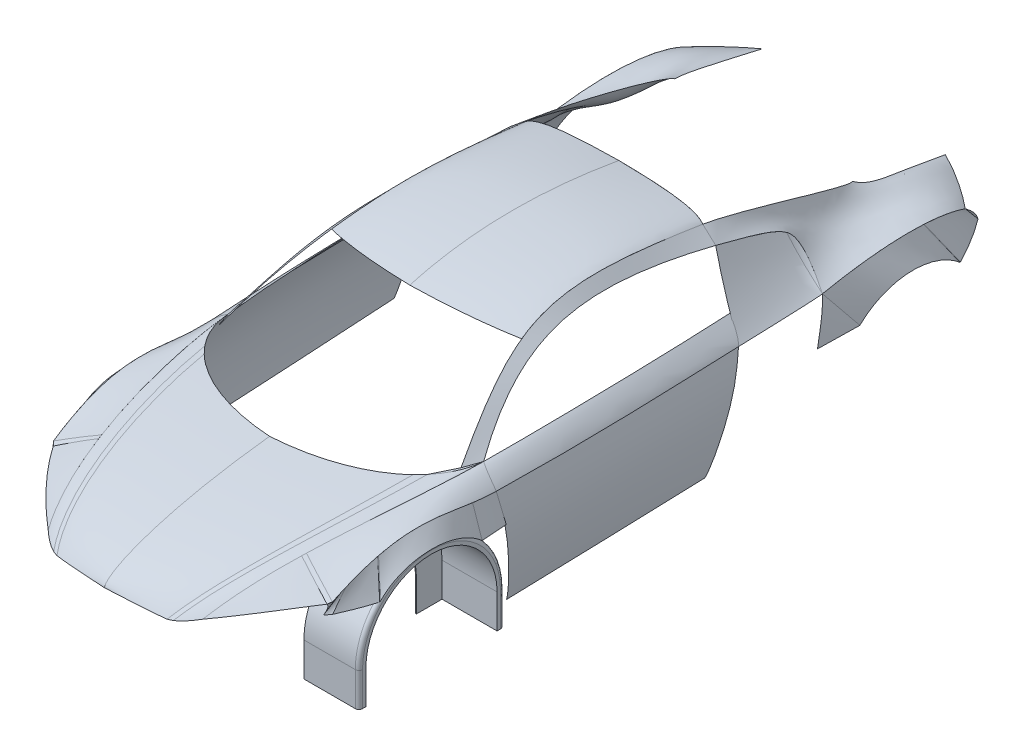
SolidWorks part; units mm, degrees
ref_plane "Front Plane" through (0, 0, 0) normal (0, 0, 1) x (1, 0, 0)
ref_plane "Top Plane" through (0, 0, 0) normal (0, 1, 0) x (1, 0, 0)
ref_plane "Right Plane" through (0, 0, 0) normal (1, 0, 0) x (0, 0, -1)
sketch "Front View Audi R8"
sketch "Side View Audi R8"
sketch "Top View Audi R8"
ref_plane "Rear Plane" through (0, 0, -4431) normal (0, 0, 1) x (1, 0, 0)
sketch "Rear View Audi R8"
sketch "Sketch1" plane through (0, 0, 0) normal (1, 0, 0) x (0, 0, -1)
  spline S0 degree 2 poles (1428.6782, 826.8415) (1886.7808, 852.6113) (2789.3564, 869.7489) knots 0 0 0 1 1 1
sketch "Sketch2" plane through (0, 0, 0) normal (0, 1, 0) x (1, 0, 0)
  spline S0 degree 3 poles (705.164, 1440.3029) (730.5597, 1835.8101) (729.8295, 2428.7311) (718.3423, 2787.8085) knots 0 0 0 0 1 1 1 1
curve "Curve1"
sketch "Sketch3" plane through (0, 0, 0) normal (1, 0, 0) x (0, 0, -1)
  spline S0 degree 2 poles (1408.5355, 746.0644) (1922.2158, 750.257) (2751.8469, 774.6725) knots 0 0 0 1 1 1
sketch "Sketch4" plane through (0, 0, 0) normal (0, 1, 0) x (1, 0, 0)
  spline S0 degree 3 poles (806.5504, 2746.6217) (807.7331, 2449.6597) (820.0794, 2025.1062) (801.0457, 1414.1873) knots 0 0 0 0 1 1 1 1
curve "Curve2"
sketch "Sketch5" plane through (0, 0, 0) normal (1, 0, 0) x (0, 0, -1)
  spline S0 degree 2 poles (1440.3029, 827.4901) (1417.7829, 811.024) (1414.661, 746.115) knots 0 0 0 1 1 1
  spline S1 degree 3 poles (2787.8085, 869.7195) (2731.6457, 868.6522) (2675.4768, 867.5353) (2563.1321, 865.1869) (2506.9561, 863.9554) (2338.4203, 860.0594) (2226.0532, 857.1983) (2001.3722, 850.7012) (1889.0328, 847.0738) (1720.6415, 840.6761) (1664.5313, 838.3819) (1552.3674, 833.3368) (1496.3131, 830.5896) (1440.3029, 827.4901) knots 0 0 0 0 0.125 0.125 0.25 0.25 0.5 0.5 0.75 0.75 0.875 0.875 1 1 1 1 construction
  spline S2 degree 3 poles (1414.1873, 746.1111) (1525.2078, 747.0381) (1636.2383, 748.5585) (1858.3266, 752.3126) (1969.3802, 754.5543) (2191.4673, 759.5367) (2302.5088, 762.2801) (2469.056, 766.6744) (2524.5695, 768.1863) (2635.5952, 771.2928) (2691.1073, 772.8874) (2746.6217, 774.5189) knots 0 0 0 0 0.25 0.25 0.5 0.5 0.75 0.75 0.875 0.875 1 1 1 1 construction
sketch "Sketch6" plane through (0, 0, 0) normal (0, 1, 0) x (1, 0, 0)
  spline S0 degree 2 poles (705.2031, 1440.9116) (743.5412, 1417.487) (801.0508, 1414.3495) knots 0 0 0 1 1 1
  spline S1 degree 3 poles (718.3423, 2787.8085) (720.139, 2731.6457) (721.5067, 2675.4768) (723.6776, 2563.1321) (724.4731, 2506.9561) (726.1346, 2338.4203) (726.292, 2226.0532) (724.6866, 2001.3722) (722.9339, 1889.0328) (718.2644, 1720.6415) (716.3625, 1664.5313) (711.6053, 1552.3674) (708.7605, 1496.3131) (705.164, 1440.3029) knots 0 0 0 0 0.125 0.125 0.25 0.25 0.5 0.5 0.75 0.75 0.875 0.875 1 1 1 1 construction
  spline S2 degree 3 poles (801.0457, 1414.1873) (804.5047, 1525.2078) (807.1155, 1636.2383) (810.6084, 1858.3266) (811.4829, 1969.3802) (811.6541, 2191.4673) (810.924, 2302.5088) (809.2256, 2469.056) (808.5647, 2524.5695) (807.3423, 2635.5952) (806.7715, 2691.1073) (806.5504, 2746.6217) knots 0 0 0 0 0.25 0.25 0.5 0.5 0.75 0.75 0.875 0.875 1 1 1 1 construction
curve "Curve3"
sketch "Sketch7" plane through (0, 0, 0) normal (1, 0, 0) x (0, 0, -1)
  spline S0 degree 2 poles (2787.8085, 869.7195) (2763.5948, 797.8808) (2743.2754, 774.4206) knots 0 0 0 1 1 1
  spline S1 degree 3 poles (2787.8085, 869.7195) (2731.6457, 868.6522) (2675.4768, 867.5353) (2563.1321, 865.1869) (2506.9561, 863.9554) (2338.4203, 860.0594) (2226.0532, 857.1983) (2001.3722, 850.7012) (1889.0328, 847.0738) (1720.6415, 840.6761) (1664.5313, 838.3819) (1552.3674, 833.3368) (1496.3131, 830.5896) (1440.3029, 827.4901) knots 0 0 0 0 0.125 0.125 0.25 0.25 0.5 0.5 0.75 0.75 0.875 0.875 1 1 1 1 construction
  spline S2 degree 3 poles (1414.1873, 746.1111) (1525.2078, 747.0381) (1636.2383, 748.5585) (1858.3266, 752.3126) (1969.3802, 754.5543) (2191.4673, 759.5367) (2302.5088, 762.2801) (2469.056, 766.6744) (2524.5695, 768.1863) (2635.5952, 771.2928) (2691.1073, 772.8874) (2746.6217, 774.5189) knots 0 0 0 0 0.25 0.25 0.5 0.5 0.75 0.75 0.875 0.875 1 1 1 1 construction
sketch "Sketch8" plane through (0, 0, 0) normal (0, 1, 0) x (1, 0, 0)
  spline S0 degree 2 poles (718.3423, 2787.8085) (790.5151, 2766.1674) (806.5519, 2746.2486) knots 0 0 0 1 1 1
  spline S1 degree 3 poles (718.3423, 2787.8085) (720.139, 2731.6457) (721.5067, 2675.4768) (723.6776, 2563.1321) (724.4731, 2506.9561) (726.1346, 2338.4203) (726.292, 2226.0532) (724.6866, 2001.3722) (722.9339, 1889.0328) (718.2644, 1720.6415) (716.3625, 1664.5313) (711.6053, 1552.3674) (708.7605, 1496.3131) (705.164, 1440.3029) knots 0 0 0 0 0.125 0.125 0.25 0.25 0.5 0.5 0.75 0.75 0.875 0.875 1 1 1 1 construction
  spline S2 degree 3 poles (801.0457, 1414.1873) (804.5047, 1525.2078) (807.1155, 1636.2383) (810.6084, 1858.3266) (811.4829, 1969.3802) (811.6541, 2191.4673) (810.924, 2302.5088) (809.2256, 2469.056) (808.5647, 2524.5695) (807.3423, 2635.5952) (806.7715, 2691.1073) (806.5504, 2746.6217) knots 0 0 0 0 0.25 0.25 0.5 0.5 0.75 0.75 0.875 0.875 1 1 1 1 construction
curve "Curve4"
surface "Surface-Loft1"
sketch "Sketch11" plane through (0, 0, 0) normal (1, 0, 0) x (0, 0, -1)
  spline S0 degree 3 poles (2513.9659, 291.6627) (2260.0908, 279.3432) (1897.9939, 262.4992) (1427.5698, 243.2458) knots 0 0 0 0 1 1 1 1
sketch "Sketch12" plane through (0, 0, 0) normal (0, 1, 0) x (1, 0, 0)
  spline S0 degree 1 poles (844.1348, 1416.9072) (858.5007, 2509.2941) knots 0 0 1 1
curve "Curve6"
sketch "Sketch16" plane through (0, 0, 0) normal (1, 0, 0) x (0, 0, -1)
  spline S0 degree 2 poles (2746.6217, 774.5189) (2567.4192, 353.4796) (2508.6204, 291.4034) knots 0 0 0 1 1 1
  spline S1 degree 3 poles (2509.2941, 291.4361) (2148.7842, 273.9547) (1788.2013, 258.0056) (1427.5698, 243.2458) knots 0 0 0 0 1 1 1 1 construction
sketch "Sketch17" plane through (0, 0, 0) normal (0, 1, 0) x (1, 0, 0)
  line L0 (858.5007, 2509.2941) -> (844.275, 1427.5698) construction
  spline S0 degree 3 poles (806.5504, 2746.6217) (855.5306, 2685.6074) (867.8574, 2640.3171) (858.4798, 2507.7028) knots 0 0 0 0 1 1 1 1
curve "Curve8"
surface "Surface-Loft2"
sketch "Sketch18" plane through (0, 0, 0) normal (1, 0, 0) x (0, 0, -1)
  spline S0 degree 2 poles (2746.6217, 774.5189) (3168.0734, 779.6193) (3218.7511, 787.241) knots 0 0 0 1 1 1
sketch "Sketch19" plane through (0, 0, 0) normal (0, 1, 0) x (1, 0, 0)
  spline S0 degree 2 poles (806.5504, 2746.6217) (805.4175, 3038.5008) (798.3297, 3216.7936) knots 0 0 0 1 1 1
curve "Curve10"
sketch "Sketch20" plane through (0, 0, 0) normal (1, 0, 0) x (0, 0, -1)
  spline S0 degree 2 poles (2853.7058, 1076.1229) (3132.7599, 1018.7829) (3211.4713, 983.5418) knots 0 0 0 1 1 1
sketch "Sketch21" plane through (0, 0, 0) normal (0, 1, 0) x (1, 0, 0)
  spline S0 degree 1 poles (566.9061, 2852.3388) (601.1217, 3222.6865) knots 0 0 1 1
curve "Curve11"
surface "Surface-Knit1"
sketch "Sketch22" plane through (0, 0, 0) normal (1, 0, 0) x (0, 0, -1)
  spline S1 degree 3 poles (166.7135, 570.3457) (356.5419, 711.1668) (713.8164, 794.4388) (1440.3029, 827.4901) knots 0 0 0 0 1 1 1 1
sketch "Sketch24" plane through (0, 0, 0) normal (0, 1, 0) x (1, 0, 0)
  spline S0 degree 3 poles (423.2978, 160.7351) (521.9825, 342.807) (681.5816, 1027.9178) (705.164, 1440.3029) knots 0 0 0 0 1 1 1 1
curve "Curve12"
sketch "Sketch25" plane through (0, 0, 0) normal (0, 1, 0) x (1, 0, 0)
  line L0 (0, -725.1255) -> (0, 725.1255) construction
  line L1 (0, 166.7135) -> (0, 1440.3029) construction
  spline S0 degree 3 poles (705.164, 1440.3029) (686.7542, 1177.0729) (396.9525, 988.6463) (0, 962.8897) knots 0 0 0 0 1 1 1 1
sketch "Sketch27" plane through (0, 0, 0) normal (1, 0, 0) x (0, 0, -1)
  line L3 (962.8897, 0) -> (962.8897, 2273.9137) construction
  spline S0 degree 1 poles (1440.3029, 827.4901) (962.8897, 833.9857) knots 0 0 1 1
curve "Curve13"
sketch "Sketch28" plane through (0, 0, 0) normal (1, 0, 0) x (0, 0, -1)
  spline S2 degree 3 poles (962.8809, 833.987) (354.1408, 764.7137) (56.7003, 627.7857) (51.3469, 565.1912) knots 0 0 0 0 1 1 1 1
sketch "Sketch30" plane through (0, 0, 0) normal (0, 1, 0) x (1, 0, 0)
  line L1 (0, -725.1255) -> (0, 725.1255) construction
  spline S0 degree 2 poles (423.2978, 160.7351) (370.639, 114.4835) (328.0977, 97.3733) knots 0 0 0 1 1 1
  spline S1 degree 2 poles (0, 56.6169) (258.3276, 73.121) (328.0977, 97.3733) knots 0 0 0 1 1 1
sketch "Sketch31" plane through (0, 0, 0) normal (1, 0, 0) x (0, 0, -1)
  spline S0 degree 1 poles (51.3469, 565.1912) (90.059, 544.3675) knots 0 0 1 1
  spline S1 degree 1 poles (90.059, 544.3675) (166.7135, 570.3457) knots 0 0 1 1
curve "Curve14"
surface "Surface-Loft4"
sketch "Sketch32" plane through (0, 0, 0) normal (1, 0, 0) x (0, 0, -1)
  spline S0 degree 3 poles (1414.1873, 746.1111) (1230.5727, 749.0045) (1160.5603, 784.7669) (990.9877, 780.0125) knots 0 0 0 0 1 1 1 1
  spline S1 degree 2 poles (990.9877, 780.0125) (769.8549, 775.0439) (523.9418, 628.716) knots 0 0 0 1 1 1
  spline S2 degree 3 poles (166.7135, 570.3457) (308.5429, 610.4682) (405.1047, 624.322) (523.9418, 628.716) knots 0 0 0 0 1 1 1 1
  spline S3 degree 1 poles (92.4284, 546.6531) (166.7135, 570.3457) knots 0 0 1 1
sketch "Sketch33" plane through (0, 0, 0) normal (0, 1, 0) x (1, 0, 0)
  spline S1 degree 3 poles (801.0457, 1414.1873) (795.7108, 1043.2584) (782.7383, 743.1049) (770.4202, 539.8306) knots 0 0 0 0 0.995264 0.995264 0.995264 0.995264
  spline S2 degree 3 poles (426.4666, 166.7135) (666.9588, 364.1571) (745.8449, 521.9796) (770.4202, 539.8306) knots 0 0 0 0 1 1 1 1
curve "Curve15"
surface "Surface-Loft6"
sketch "Sketch34" plane through (0, 0, 0) normal (1, 0, 0) x (0, 0, -1)
  spline S0 degree 1 poles (1425.7898, 602.8072) (1283.8785, 601.7667) knots 0 0 1 1
  spline S1 degree 3 poles (1426.8962, 243.2131) (1428.2442, 247.5995) (1430.1162, 256.9134) (1432.5664, 276.3921) (1434.1988, 301.6806) (1435.0914, 332.7528) (1435.3041, 374.6862) (1434.3432, 427.7651) (1431.9716, 491.8634) (1429.263, 545.4122) (1426.7604, 588.2728) (1423.9454, 630.8821) (1419.874, 683.6228) (1416.1377, 725.3255) (1414.1873, 746.1111) knots 0 0 0 0 0.03125 0.0625 0.125 0.1875 0.25 0.375 0.5 0.625 0.6875 0.75 0.875 1 1 1 1 construction
  spline S2 degree 1 poles (513.1356, 577.4986) (720.8256, 587.0843) knots 0 0 1 1
  spline S3 degree 3 poles (720.8256, 587.0843) (837.9393, 726.6038) (1108.5769, 755.6842) (1283.8785, 601.7667) knots 0 0 0 0 1 1 1 1
  spline S4 degree 2 poles (523.9418, 628.716) (532.423, 614.2875) (513.1356, 577.4986) knots 0 0 0 1 1 1
sketch "Sketch35" plane through (0, 0, 0) normal (0, 1, 0) x (1, 0, 0)
  spline S0 degree 2 poles (770.4202, 539.8306) (823.0419, 642.18) (851.5058, 724.2331) knots 0 0 0 1 1 1
  spline S1 degree 3 poles (851.5058, 724.2331) (860.8621, 946.7661) (864.4796, 1181.5274) (844.3187, 1426.8962) knots 0 0 0 0 1 1 1 1
  spline S2 degree 3 poles (426.4666, 166.7135) (571.8997, 274.5997) (760.141, 534.0673) (770.4202, 539.8306) knots 0 0 0 0 1 1 1 1
curve "Curve16"
surface "Surface-Loft7"
sketch "Sketch39" plane through (0, 0, 0) normal (1, 0, 0) x (0, 0, -1)
  line L0 (1493.001, 314.9487) -> (584.0039, 314.9487) construction
  line L1 (1003.7078, 732.7326) -> (1003.7078, -54.9122) construction
  line L2 (641.5034, 314.9487) -> (641.5034, 128.0571)
  line L3 (641.5034, 128.0571) -> (602.7587, 128.0571)
  line L4 (602.7587, 128.0571) -> (602.7587, 314.9487)
  line L5 (1365.9122, 314.9487) -> (1365.9122, 128.0571)
  line L6 (1365.9122, 128.0571) -> (1404.6569, 128.0571)
  line L7 (1404.6569, 128.0571) -> (1404.6569, 314.9487)
  line L8 (1404.6569, 314.9487) -> (1407.1755, 316.3853)
  arc A2 (1365.9122, 314.9487) -> (641.5034, 314.9487) centre (1003.7078, 314.9487) ccw
  arc A3 (1404.6569, 314.9487) -> (602.7587, 314.9487) centre (1003.7078, 314.9487) ccw
extrude "Boss-Extrude3" add sketch "Sketch39" along normal up to vertex contours A3 L4 L3 L2 A2 L5 L6 L7
sketch "Sketch40" plane through (0, 0, -4431) normal (0, 0, 1) x (1, 0, 0)
  line L1 (549.6351, 101.7431) -> (-37.9847, 101.7431)
  line L2 (549.6351, 101.7431) -> (549.6351, 756.3824)
  line L3 (549.6351, 756.3824) -> (-37.9847, 756.3824)
  line L4 (-37.9847, 101.7431) -> (-37.9847, 756.3824)
extrude "Cut-Extrude2" cut sketch "Sketch40" along normal up to vertex
fillet "Fillet1" radius 20 3 edges at (853.5675, 221.5029, -1404.6569) (853.5675, 221.5029, -602.7587) (853.5675, 715.8979, -1003.7078)
sketch "Sketch42" plane through (0, 0, 0) normal (0, 1, 0) x (1, 0, 0)
  line L1 (546.0539, 1410.5372) -> (490.4985, 1410.5372)
  line L2 (546.0539, 1410.5372) -> (546.0539, 641.5034)
  line L3 (546.0539, 641.5034) -> (490.4985, 641.5034)
  line L4 (490.4985, 1410.5372) -> (490.4985, 641.5034)
  spline S0 degree 3 poles (576.8385, 1178.623) (574.0102, 1148.8218) (567.6143, 1090.1219) (560.1474, 1033.1626) (548.3159, 949.0014) (539.5986, 894.5954) (520.9824, 789.1082) (501.1708, 686.9476) (479.3637, 591.3834) (456.6039, 499.1271) (444.7746, 454.7747) (426.3329, 391.0785) (413.8024, 349.5544) (397.4947, 300.083) (387.3725, 271.5524) (380.5405, 252.797) (377.0794, 243.5407) (366.5883, 216.3005) (359.4506, 198.8288) (344.7741, 165.4357) (333.4802, 141.5492) (321.3949, 119.7105) (313.053, 105.6635) (308.7473, 98.894) (304.1673, 92.4284) knots 0 0 0 0 0.0625 0.125 0.125 0.25 0.25 0.375 0.5 0.5 0.625 0.625 0.6875 0.75 0.78125 0.78125 0.8125 0.8125 0.875 0.875 0.9375 0.96875 0.96875 1 1 1 1 construction
sketch "Sketch44" plane through (549.6351, 0, 0) normal (-1, 0, 0) x (0, 0, 1)
  line L0 (-1365.9122, 314.9487) -> (-641.5034, 314.9487) construction
  line L1 (-783.5699, 314.9487) -> (-783.5699, -70.0711)
  line L2 (-783.5699, -70.0711) -> (-1223.8457, -70.0711)
  line L3 (-1223.8457, -70.0711) -> (-1223.8457, 314.9487)
  arc A0 (-783.5699, 314.9487) -> (-1223.8457, 314.9487) centre (-1003.7078, 314.9487) ccw
sketch "Sketch43" plane through (549.6351, 0, 0) normal (-1, 0, 0) x (0, 0, 1)
  line L0 (-536.1833, 314.9487) -> (-1526.8557, 314.9487) construction
  line L1 (-1365.9122, 314.9487) -> (-1365.9122, 128.0571)
  line L2 (-1365.9122, 128.0571) -> (-641.5034, 128.0571)
  line L3 (-641.5034, 128.0571) -> (-641.5034, 314.9487)
  arc A0 (-641.5034, 314.9487) -> (-1365.9122, 314.9487) centre (-1003.7078, 314.9487) ccw
extrude "Boss-Extrude4" add sketch "Sketch43" along normal blind 5 separate body
extrude "Cut-Extrude7" cut sketch "Sketch44" against normal mid plane 295
sketch "Sketch45" plane through (0, 0, 0) normal (1, 0, 0) x (0, 0, -1)
  line L0 (720.8256, 587.0843) -> (513.1356, 577.4986)
sketch "Sketch46" plane through (0, 0, 0) normal (0, 0, 1) x (1, 0, 0)
  spline S0 degree 2 poles (747.8302, 577.4986) (802.3688, 581.4688) (850.3165, 587.0843) knots 0 0 0 1 1 1
curve "Curve19"
sketch "Sketch47" plane through (0, 0, 0) normal (1, 0, 0) x (0, 0, -1)
  line L0 (0, 725.1255) -> (0, -725.1255) construction
  spline S0 degree 1 poles (0, 230.0465) (610.4807, 236.9986) knots 0 0 1 1
sketch "Sketch49" plane through (0, 0, 0) normal (0, 1, 0) x (1, 0, 0)
  line L0 (0, 0) -> (0, 610.4807) construction
  spline S0 degree 2 poles (0, 9.8608) (267.2971, 16.5079) (294.9318, 26.4785) knots 0 0 0 1 1 1
  spline S1 degree 3 poles (294.9318, 26.4785) (585.9892, 191.2531) (816.308, 423.5727) (850.3165, 643.9242) knots 0 0 0 0 1 1 1 1
curve "Curve20"
sketch "Sketch50" plane through (0, 0, 0) normal (1, 0, 0) x (0, 0, -1)
  spline S0 degree 3 poles (513.1356, 577.4986) (391.6779, 367.5407) (486.537, 226.6932) (51.2084, 256.4789) knots 0 0 0 0 1 1 1 1
sketch "Sketch52" plane through (0, 0, 0) normal (0, 1, 0) x (1, 0, 0)
  spline S0 degree 2 poles (328.9442, 94.2769) (614.0189, 308.6187) (747.8302, 513.1356) knots 0 0 0 1 1 1
curve "Curve21"
sketch "Sketch53" plane through (0, 0, 0) normal (1, 0, 0) x (0, 0, -1)
  spline S0 degree 2 poles (2746.6217, 774.5189) (3205.7085, 780.7641) (3219.2513, 786.4465) knots 0 0 0 1 1 1
sketch "Sketch54" plane through (0, 0, 0) normal (0, 1, 0) x (1, 0, 0)
  spline S0 degree 1 poles (806.5504, 2746.6217) (797.5326, 3219.5986) knots 0 0 1 1
curve "Curve22"
sketch "Sketch55" plane through (0, 0, 0) normal (1, 0, 0) x (0, 0, -1)
  line L0 (3217.9155, 786.075) -> (3217.9155, 1159.6735) construction
  spline S0 degree 3 poles (2859.0843, 1083.0587) (3061.7957, 1039.6964) (3167.9128, 1013.6083) (3217.9155, 982.3078) knots 0 0 0 0 0.436059 0.436059 0.436059 0.436059
  spline S1 degree 3 poles (3219.2513, 786.4465) (3218.6559, 786.1967) (3218.047, 786.0983) (3216.8311, 785.878) (3216.2214, 785.788) (3214.3901, 785.5415) (3213.1662, 785.4099) (3209.4916, 785.0504) (3207.0373, 784.8606) (3199.6699, 784.3421) (3194.7515, 784.0699) (3179.9908, 783.3259) (3170.1469, 782.9361) (3140.6118, 781.8699) (3120.9168, 781.3105) (3061.8271, 779.7786) (3022.4282, 778.9723) (2904.2307, 776.7607) (2825.427, 775.5909) (2746.6217, 774.5189) knots 0 0 0 0 0.003906 0.003906 0.007812 0.007812 0.015625 0.015625 0.03125 0.03125 0.0625 0.0625 0.125 0.125 0.25 0.25 0.5 0.5 1 1 1 1 construction
sketch "Sketch56" plane through (0, 0, 0) normal (0, 1, 0) x (1, 0, 0)
  line L0 (797.5392, 3219.2513) -> (806.5504, 2746.6217) construction
  line L1 (0, 2859.0843) -> (698.7428, 2859.0843) construction
  line L2 (0, 2859.0843) -> (0, 3217.9155) construction
  line L3 (0, 3217.9155) -> (797.5392, 3219.2513) construction
  spline S0 degree 3 poles (601.4319, 3218.9228) (583.617, 3167.7712) (581.0101, 3058.405) (567.2137, 2848.2126) knots 0.559845 0.559845 0.559845 0.559845 1 1 1 1
curve "Curve23"
sketch "Sketch57" plane through (0, 0, 0) normal (1, 0, 0) x (0, 0, -1)
  spline S0 degree 3 poles (2859.0843, 1083.0587) (2824.8474, 982.6742) (2787.3432, 859.4639) (2746.6217, 774.5189) knots 0 0 0 0 1 1 1 1
  spline S1 degree 3 poles (2859.0843, 1083.0587) (2889.6622, 1076.5177) (2920.2312, 1069.9092) (2981.2922, 1056.3252) (3011.7931, 1049.362) (3057.3528, 1038.2264) (3072.5062, 1034.3966) (3102.6943, 1026.3317) (3117.7511, 1022.0956) (3147.5119, 1012.9204) (3162.2245, 1007.9983) (3183.7315, 999.5398) (3190.8047, 996.5373) (3204.6436, 989.9535) (3211.4127, 986.3784) (3217.9155, 982.3078) knots 0 0 0 0 0.25 0.25 0.5 0.5 0.625 0.625 0.75 0.75 0.875 0.875 0.9375 0.9375 1 1 1 1 construction
sketch "Sketch58" plane through (0, 0, 0) normal (0, 1, 0) x (1, 0, 0)
  spline S0 degree 3 poles (567.9233, 2859.0843) (668.5804, 2807.6822) (703.5134, 2796.2323) (806.5504, 2746.6217) knots 0 0 0 0 1 1 1 1
  spline S1 degree 3 poles (567.9233, 2859.0843) (569.9078, 2889.6622) (571.7938, 2920.2312) (575.4963, 2981.2922) (577.3018, 3011.7931) (580.2425, 3057.3528) (581.2637, 3072.5062) (583.5191, 3102.6943) (584.7504, 3117.7511) (587.6911, 3147.5119) (589.3844, 3162.2245) (592.782, 3183.7315) (594.0611, 3190.8047) (597.1123, 3204.6436) (598.8787, 3211.4127) (601.0856, 3217.9155) knots 0 0 0 0 0.25 0.25 0.5 0.5 0.625 0.625 0.75 0.75 0.875 0.875 0.9375 0.9375 1 1 1 1 construction
curve "Curve24"
sketch "Sketch59" plane through (0, 0, 0) normal (1, 0, 0) x (0, 0, -1)
  spline S0 degree 2 poles (3219.2513, 786.4465) (3291.9157, 949.707) (3217.9155, 982.3078) knots 0 0 0 1 1 1
  spline S1 degree 3 poles (3219.2513, 786.4465) (3218.6559, 786.1967) (3218.047, 786.0983) (3216.8311, 785.878) (3216.2214, 785.788) (3214.3901, 785.5415) (3213.1662, 785.4099) (3209.4916, 785.0504) (3207.0373, 784.8606) (3199.6699, 784.3421) (3194.7515, 784.0699) (3179.9908, 783.3259) (3170.1469, 782.9361) (3140.6118, 781.8699) (3120.9168, 781.3105) (3061.8271, 779.7786) (3022.4282, 778.9723) (2904.2307, 776.7607) (2825.427, 775.5909) (2746.6217, 774.5189) knots 0 0 0 0 0.003906 0.003906 0.007812 0.007812 0.015625 0.015625 0.03125 0.03125 0.0625 0.0625 0.125 0.125 0.25 0.25 0.5 0.5 1 1 1 1 construction
  spline S2 degree 3 poles (2859.0843, 1083.0587) (2889.6622, 1076.5177) (2920.2312, 1069.9092) (2981.2922, 1056.3252) (3011.7931, 1049.362) (3057.3528, 1038.2264) (3072.5062, 1034.3966) (3102.6943, 1026.3317) (3117.7511, 1022.0956) (3147.5119, 1012.9204) (3162.2245, 1007.9983) (3183.7315, 999.5398) (3190.8047, 996.5373) (3204.6436, 989.9535) (3211.4127, 986.3784) (3217.9155, 982.3078) knots 0 0 0 0 0.25 0.25 0.5 0.5 0.625 0.625 0.75 0.75 0.875 0.875 0.9375 0.9375 1 1 1 1 construction
sketch "Sketch60" plane through (0, 0, 0) normal (0, 1, 0) x (1, 0, 0)
  line L0 (797.5392, 3219.2513) -> (806.5504, 2746.6217) construction
  spline S0 degree 2 poles (600.7135, 3216.8039) (629.6403, 3292.4661) (797.5527, 3218.543) knots 0 0 0 1 1 1
  spline S1 degree 3 poles (567.9233, 2859.0843) (569.9078, 2889.6622) (571.7938, 2920.2312) (575.4963, 2981.2922) (577.3018, 3011.7931) (580.2425, 3057.3528) (581.2637, 3072.5062) (583.5191, 3102.6943) (584.7504, 3117.7511) (587.6911, 3147.5119) (589.3844, 3162.2245) (592.782, 3183.7315) (594.0611, 3190.8047) (597.1123, 3204.6436) (598.8787, 3211.4127) (601.0856, 3217.9155) knots 0 0 0 0 0.25 0.25 0.5 0.5 0.625 0.625 0.75 0.75 0.875 0.875 0.9375 0.9375 1 1 1 1 construction
sketch3d "3DSketch1"
  spline S0 degree 2 poles (601.0856, 982.3078, -3217.9155) (620.2659, 939.3786, -3290.4923) (797.5392, 786.4465, -3219.2513) knots 0 0 0 1 1 1
  spline S1 degree 3 poles (567.9233, 1083.0587, -2859.0843) (569.9078, 1076.5177, -2889.6622) (571.7938, 1069.9092, -2920.2312) (575.4963, 1056.3252, -2981.2922) (577.3018, 1049.362, -3011.7931) (580.2425, 1038.2264, -3057.3528) (581.2637, 1034.3966, -3072.5062) (583.5191, 1026.3317, -3102.6943) (584.7504, 1022.0956, -3117.7511) (587.6911, 1012.9204, -3147.5119) (589.3844, 1007.9983, -3162.2245) (592.782, 999.5398, -3183.7315) (594.0611, 996.5373, -3190.8047) (597.1123, 989.9535, -3204.6436) (598.8787, 986.3784, -3211.4127) (601.0856, 982.3078, -3217.9155) knots 0 0 0 0 0.25 0.25 0.5 0.5 0.625 0.625 0.75 0.75 0.875 0.875 0.9375 0.9375 1 1 1 1 construction
  spline S2 degree 3 poles (797.5392, 786.4465, -3219.2513) (797.5505, 786.1967, -3218.6559) (797.5622, 786.0983, -3218.047) (797.5853, 785.878, -3216.8311) (797.597, 785.788, -3216.2214) (797.6319, 785.5415, -3214.3901) (797.6552, 785.4099, -3213.1662) (797.7253, 785.0504, -3209.4916) (797.7721, 784.8606, -3207.0373) (797.9125, 784.3421, -3199.6699) (798.0063, 784.0699, -3194.7515) (798.2877, 783.3259, -3179.9908) (798.4754, 782.9361, -3170.1469) (799.0386, 781.8699, -3140.6118) (799.4141, 781.3105, -3120.9168) (800.5407, 779.7786, -3061.8271) (801.2919, 778.9723, -3022.4282) (803.5454, 776.7607, -2904.2307) (805.0479, 775.5909, -2825.427) (806.5504, 774.5189, -2746.6217) knots 0 0 0 0 0.003906 0.003906 0.007812 0.007812 0.015625 0.015625 0.03125 0.03125 0.0625 0.0625 0.125 0.125 0.25 0.25 0.5 0.5 1 1 1 1 construction
surface "Surface-Loft10"
surface "Surface-Loft13"
sketch "Sketch61" plane through (0, 0, 0) normal (1, 0, 0) x (0, 0, -1)
  spline S0 degree 2 poles (962.8897, 833.9857) (1217.4637, 833.8708) (1440.3029, 827.4901) knots 0 0 0 1 1 1
sketch "Sketch62" plane through (0, 0, 0) normal (0, 1, 0) x (1, 0, 0)
  spline S0 degree 2 poles (0, 1086.416) (576.8412, 1141.6106) (613.975, 1346.322) knots 0 0 0 1 1 1
curve "Curve25"
sketch "Sketch63" plane through (0, 0, 0) normal (1, 0, 0) x (0, 0, -1)
  spline S0 degree 3 poles (1440.3029, 827.4901) (1792.6008, 1139.8524) (2058.4105, 1212.0328) (2859.0843, 1083.0587) knots 0 0 0 0 1 1 1 1
sketch "Sketch65" plane through (0, 0, 0) normal (0, 1, 0) x (1, 0, 0)
  spline S0 degree 2 poles (567.9233, 2859.0843) (459.1, 1947.101) (705.164, 1440.3029) knots 0 0 0 1 1 1
curve "Curve26"
sketch "Sketch66" plane through (0, 0, 0) normal (1, 0, 0) x (0, 0, -1)
  spline S0 degree 3 poles (1346.322, 828.7688) (1819.9853, 1221.4426) (2094.3958, 1252.7554) (2865.6541, 1142.5441) knots 0 0 0 0 1 1 1 1
sketch "Sketch67" plane through (0, 0, 0) normal (0, 1, 0) x (1, 0, 0)
  spline S0 degree 3 poles (679.9818, 1329.3565) (473.2348, 1902.1352) (475.0793, 1964.9253) (490.0895, 2869.8591) knots 0 0 0 0 1 1 1 1
  spline S2 degree 3 poles (705.164, 1440.3029) (703.8011, 1420.8148) (699.5211, 1392.0158) (691.8337, 1363.7945) (679.3686, 1324.2645) (663.1603, 1289.3075) (635.1405, 1245.9708) (622.8982, 1229.6918) (614.7344, 1219.7318) knots 0.73965 0.73965 0.73965 0.73965 0.80215 0.8334 0.8334 0.934913 0.9584 1 1 1 1 construction
curve "Curve27"
sketch "Sketch68" plane through (0, 0, 0) normal (1, 0, 0) x (0, 0, -1)
  spline S2 degree 1 poles (1737.5333, 1169.7557) (1830.5918, 1129.217) knots 0 0 1 1
  spline S3 degree 3 poles (2865.6541, 1142.5441) (2798.32, 1152.166) (2730.9636, 1161.2767) (2596.1633, 1177.4298) (2528.7199, 1184.4866) (2427.4345, 1192.1715) (2393.6524, 1194.2423) (2326.034, 1197.0619) (2292.1978, 1197.8111) (2224.4544, 1197.5534) (2190.5473, 1196.5463) (2122.642, 1192.2425) (2088.6438, 1188.9443) (2046.0751, 1183.0089) (2037.5578, 1181.7311) (2020.5158, 1178.9843) (2011.9951, 1177.5154) (1986.5999, 1172.8436) (1969.8348, 1169.3659) (1920.0498, 1157.8206) (1887.5445, 1148.6345) (1823.8807, 1127.3233) (1792.7205, 1115.2) (1731.5994, 1088.2367) (1701.6304, 1073.3956) (1642.7068, 1041.348) (1614.0597, 1024.3168) (1557.9901, 988.648) (1530.5677, 970.0107) (1476.6317, 931.482) (1450.1186, 911.5906) (1397.7622, 870.8444) (1371.9195, 849.9894) (1346.322, 828.7688) knots 0 0 0 0 0.125 0.125 0.25 0.25 0.3125 0.3125 0.375 0.375 0.4375 0.4375 0.5 0.5 0.515625 0.515625 0.53125 0.53125 0.5625 0.5625 0.625 0.625 0.6875 0.6875 0.75 0.75 0.8125 0.8125 0.875 0.875 0.9375 0.9375 1 1 1 1 construction
sketch "Sketch69" plane through (0, 0, 0) normal (0, 1, 0) x (1, 0, 0)
  line L2 (0, 1830.5918) -> (685.1821, 1830.5918) construction
  line L3 (0, 1737.5333) -> (0, 1830.5918) construction
  spline S0 degree 2 poles (524.9421, 1830.5918) (319.7986, 1752.2082) (0, 1737.5333) knots 0 0 0 1 1 1
  spline S3 degree 3 poles (490.0198, 2865.6541) (488.9028, 2798.32) (487.7737, 2730.9636) (485.7692, 2596.1633) (484.8821, 2528.7199) (484.2212, 2427.4345) (484.1163, 2393.6524) (484.297, 2326.034) (484.5814, 2292.1978) (485.7861, 2224.4544) (486.7054, 2190.5473) (489.5479, 2122.642) (491.4723, 2088.6438) (494.8157, 2046.0751) (495.5315, 2037.5578) (497.0656, 2020.5158) (497.8838, 2011.9951) (500.4845, 1986.5999) (502.4186, 1969.8348) (508.8593, 1920.0498) (514.0162, 1887.5445) (526.008, 1823.8807) (532.8383, 1792.7205) (547.8139, 1731.5994) (555.953, 1701.6304) (573.0707, 1642.7068) (581.9527, 1614.0597) (600.009, 1557.9901) (609.1845, 1530.5677) (627.6232, 1476.6317) (636.888, 1450.1186) (655.4007, 1397.7622) (664.6497, 1371.9195) (673.8656, 1346.322) knots 0 0 0 0 0.125 0.125 0.25 0.25 0.3125 0.3125 0.375 0.375 0.4375 0.4375 0.5 0.5 0.515625 0.515625 0.53125 0.53125 0.5625 0.5625 0.625 0.625 0.6875 0.6875 0.75 0.75 0.8125 0.8125 0.875 0.875 0.9375 0.9375 1 1 1 1 construction
curve "Curve28"
sketch "Sketch71" plane through (0, 0, 0) normal (1, 0, 0) x (0, 0, -1)
  spline S0 degree 1 poles (2859.0843, 1083.0587) (2865.6081, 1142.5507) knots 0 0 1 1
  spline S1 degree 3 poles (2865.6541, 1142.5441) (2798.32, 1152.166) (2730.9636, 1161.2767) (2596.1633, 1177.4298) (2528.7199, 1184.4866) (2427.4345, 1192.1715) (2393.6524, 1194.2423) (2326.034, 1197.0619) (2292.1978, 1197.8111) (2224.4544, 1197.5534) (2190.5473, 1196.5463) (2122.642, 1192.2425) (2088.6438, 1188.9443) (2046.0751, 1183.0089) (2037.5578, 1181.7311) (2020.5158, 1178.9843) (2011.9951, 1177.5154) (1986.5999, 1172.8436) (1969.8348, 1169.3659) (1920.0498, 1157.8206) (1887.5445, 1148.6345) (1823.8807, 1127.3233) (1792.7205, 1115.2) (1731.5994, 1088.2367) (1701.6304, 1073.3956) (1642.7068, 1041.348) (1614.0597, 1024.3168) (1557.9901, 988.648) (1530.5677, 970.0107) (1476.6317, 931.482) (1450.1186, 911.5906) (1397.7622, 870.8444) (1371.9195, 849.9894) (1346.322, 828.7688) knots 0 0 0 0 0.125 0.125 0.25 0.25 0.3125 0.3125 0.375 0.375 0.4375 0.4375 0.5 0.5 0.515625 0.515625 0.53125 0.53125 0.5625 0.5625 0.625 0.625 0.6875 0.6875 0.75 0.75 0.8125 0.8125 0.875 0.875 0.9375 0.9375 1 1 1 1 construction
sketch "Sketch72" plane through (0, 0, 0) normal (0, 1, 0) x (1, 0, 0)
  spline S0 degree 2 poles (490.0198, 2865.6541) (519.9344, 2864.9415) (567.9233, 2859.0843) knots 0 0 0 1 1 1
  spline S1 degree 3 poles (490.0198, 2865.6541) (488.9028, 2798.32) (487.7737, 2730.9636) (485.7692, 2596.1633) (484.8821, 2528.7199) (484.2212, 2427.4345) (484.1163, 2393.6524) (484.297, 2326.034) (484.5814, 2292.1978) (485.7861, 2224.4544) (486.7054, 2190.5473) (489.5479, 2122.642) (491.4723, 2088.6438) (494.8157, 2046.0751) (495.5315, 2037.5578) (497.0656, 2020.5158) (497.8838, 2011.9951) (500.4845, 1986.5999) (502.4186, 1969.8348) (508.8593, 1920.0498) (514.0162, 1887.5445) (526.008, 1823.8807) (532.8383, 1792.7205) (547.8139, 1731.5994) (555.953, 1701.6304) (573.0707, 1642.7068) (581.9527, 1614.0597) (600.009, 1557.9901) (609.1845, 1530.5677) (627.6232, 1476.6317) (636.888, 1450.1186) (655.4007, 1397.7622) (664.6497, 1371.9195) (673.8656, 1346.322) knots 0 0 0 0 0.125 0.125 0.25 0.25 0.3125 0.3125 0.375 0.375 0.4375 0.4375 0.5 0.5 0.515625 0.515625 0.53125 0.53125 0.5625 0.5625 0.625 0.625 0.6875 0.6875 0.75 0.75 0.8125 0.8125 0.875 0.875 0.9375 0.9375 1 1 1 1 construction
curve "Curve29"
surface "Surface-Loft16"
sketch "Sketch73" plane through (0, 0, 0) normal (0, 1, 0) x (1, 0, 0)
  spline S0 degree 2 poles (490.0198, 2865.6541) (408.658, 2890.493) (0, 2892.3765) knots 0 0 0 1 1 1
sketch3d "3DSketch2"
  line L1 (673.8656, 828.7688, -1346.322) -> (681.5874, 828.9433, -1333.4901)
  spline S0 degree 3 poles (705.164, 827.4901, -1440.3029) (703.8011, 827.7552, -1420.8148) (699.5211, 828.1471, -1392.0158) (691.8337, 828.531, -1363.7945) (679.3686, 829.0689, -1324.2645) (663.1603, 829.5445, -1289.3075) (635.1405, 830.1341, -1245.9708) (622.8982, 830.3556, -1229.6918) (614.7344, 830.4911, -1219.7318) knots 0.73965 0.73965 0.73965 0.73965 0.80215 0.8334 0.8334 0.934913 0.9584 1 1 1 1 construction
surface "Surface-Loft17"
sketch "Sketch74" plane through (0, 0, 0) normal (1, 0, 0) x (0, 0, -1)
  spline S0 degree 2 poles (1737.5333, 1169.7557) (2217.9842, 1308.1238) (2892.6823, 1189.013) knots 0 0 0 1 1 1
sketch "Sketch75" plane through (0, 0, 0) normal (1, 0, 0) x (0, 0, -1)
  spline S0 degree 2 poles (2865.6541, 1142.5441) (2877.3985, 1170.8066) (2892.6823, 1189.013) knots 0 0 0 1 1 1
curve "Curve30"
surface "Surface-Loft18"
sketch "Sketch76" plane through (0, 0, 0) normal (0, 1, 0) x (1, 0, 0)
  spline S0 degree 1 poles (567.9233, 2859.0843) (0, 2892.3765) knots 0 0 1 1
sketch "Sketch77" plane through (0, 0, 0) normal (1, 0, 0) x (0, 0, -1)
  spline S0 degree 1 poles (2865.6541, 1142.5441) (2894.4153, 1173.9443) knots 0 0 1 1
curve "Curve31"
surface "Surface-Loft19"
sketch "Sketch78" plane through (0, 0, 0) normal (0, 1, 0) x (1, 0, 0)
  spline S0 degree 2 poles (797.5392, 3219.2513) (793.88, 3847.8674) (774.241, 4031.5413) knots 0 0 0 1 1 1
sketch "Sketch79" plane through (0, 0, 0) normal (1, 0, 0) x (0, 0, -1)
  line L0 (4031.5413, 0) -> (4031.5413, 1023.3369) construction
  line L1 (4031.5413, 0) -> (3219.2513, 0) construction
  spline S0 degree 3 poles (4031.5413, 775.5326) (3871.0242, 843.4524) (3590.8874, 859.7172) (3219.2513, 786.4465) knots 0 0 0 0 1 1 1 1
curve "Curve32"
sketch "Sketch80" plane through (0, 0, 0) normal (0, 1, 0) x (1, 0, 0)
  spline S0 degree 3 poles (490.0198, 2865.6541) (515.4835, 3405.3262) (518.2545, 3668.029) (490.0198, 3690.4757) knots 0 0 0 0 1 1 1 1
  spline S1 degree 3 poles (505.8922, 4189.7618) (513.2943, 3869.9376) (534.5662, 3773.2257) (490.0198, 3690.4757) knots 0 0 0 0 1 1 1 1
sketch "Sketch81" plane through (0, 0, 0) normal (1, 0, 0) x (0, 0, -1)
  line L0 (4189.7618, 0) -> (4189.7618, 821.1231) construction
  line L1 (4189.7618, 0) -> (3690.4757, 0) construction
  line L2 (3690.4757, 0) -> (3690.4757, 1217.2292) construction
  line L3 (3690.4757, 0) -> (2865.6541, 0) construction
  point P8 (3690.4757, 935.3874)
  point P9 (2865.6541, 1142.5441)
curve "Curve33"
sketch3d "3DSketch3"
  spline S0 degree 2 poles (774.241, 775.5326, -4031.5413) (644.5896, 796.367, -4132.351) (505.8922, 821.1231, -4189.7618) knots 0 0 0 1 1 1
  spline S1 degree 3 poles (797.5392, 786.4465, -3219.2513) (797.1467, 799.741, -3286.6821) (796.5963, 810.7723, -3354.4377) (795.4087, 823.0675, -3456.6809) (794.9513, 826.4551, -3490.8965) (793.8804, 831.5623, -3559.4005) (793.2679, 833.2833, -3593.6643) (791.8358, 834.7571, -3662.2187) (791.0172, 834.5137, -3696.5095) (789.567, 832.3225, -3747.9701) (789.0453, 831.2837, -3765.1533) (787.914, 828.5209, -3799.3667) (787.3045, 826.7982, -3816.4) (785.3101, 820.4666, -3867.2487) (783.7722, 814.7232, -3900.8195) (780.8659, 802.9027, -3950.4755) (779.7959, 798.4231, -3966.9097) (777.3304, 788.1058, -3999.4775) (775.9441, 782.2725, -4015.6125) (774.241, 775.5326, -4031.5413) knots 0 0 0 0 0.25 0.25 0.375 0.375 0.5 0.5 0.625 0.625 0.6875 0.6875 0.75 0.75 0.875 0.875 0.9375 0.9375 1 1 1 1 construction
  spline S2 degree 3 poles (490.0198, 935.3874, -3690.4757) (494.5983, 930.3961, -3698.9809) (498.6534, 926.0266, -3707.9822) (503.7515, 920.2369, -3722.2329) (505.2927, 918.4264, -3727.1199) (508.0327, 915.0273, -3737.0502) (509.2267, 913.4456, -3742.069) (512.3479, 908.9602, -3757.2531) (513.8163, 906.3099, -3767.5445) (515.9268, 901.3515, -3788.3247) (516.5717, 899.046, -3798.8138) (517.3566, 894.6017, -3819.9017) (517.4954, 892.4691, -3830.4804) (517.48, 888.2912, -3851.6301) (517.3248, 886.2452, -3862.2107) (516.614, 880.154, -3893.9569) (515.8253, 876.1506, -3915.1266) (514.129, 868.0765, -3957.4508) (513.2112, 864.0107, -3978.6048) (511.4356, 855.7639, -4020.8916) (510.5742, 851.5845, -4042.0247) (508.1882, 838.8545, -4105.3924) (506.8681, 830.1113, -4147.5956) (505.8922, 821.1231, -4189.7618) knots 0 0 0 0 0.0625 0.0625 0.09375 0.09375 0.125 0.125 0.1875 0.1875 0.25 0.25 0.3125 0.3125 0.375 0.375 0.5 0.5 0.625 0.625 0.75 0.75 1 1 1 1 construction
surface "Surface-Fill1"
sketch "Sketch83" plane through (0, 0, 0) normal (1, 0, 0) x (0, 0, -1)
  spline S0 degree 1 poles (3219.2513, 786.4465) (3138.0524, 590.1255) knots 0 0 1 1
sketch "Sketch84" plane through (0, 0, 0) normal (0, 1, 0) x (1, 0, 0)
  line L0 (0, 3138.0524) -> (1100.5679, 3138.0524) construction
  line L1 (0, 3138.0524) -> (0, 3219.2513) construction
  line L2 (0, 3219.2513) -> (1100.5679, 3219.2513) construction
  spline S0 degree 2 poles (797.5392, 3219.2513) (824.1206, 3198.5159) (851.4071, 3138.0524) knots 0 0 0 1 1 1
curve "Curve34"
sketch "Sketch85" plane through (0, 0, 0) normal (1, 0, 0) x (0, 0, -1)
  line L1 (3219.2513, 786.4465) -> (3138.0524, 590.1255) construction
  spline S0 degree 1 poles (3138.5179, 591.251) (3356.6828, 597.6914) knots 0 0 1 1
sketch "Sketch86" plane through (0, 0, 0) normal (0, 1, 0) x (1, 0, 0)
  line L0 (0, 3138.5179) -> (1358.7615, 3138.5179) construction
  line L1 (0, 3138.5179) -> (0, 3356.6828) construction
  line L2 (0, 3356.6828) -> (1125.7033, 3356.6828) construction
  spline S0 degree 1 poles (851.1968, 3138.5179) (866.7369, 3356.6828) knots 0 0 1 1
  spline S1 degree 3 poles (797.5392, 3219.2513) (801.5849, 3216.0954) (804.9464, 3212.845) (811.1034, 3206.2661) (813.8714, 3202.9337) (821.6349, 3192.8621) (826.0841, 3186.0698) (834.2827, 3172.4308) (838.0142, 3165.5759) (845.0218, 3151.8366) (848.2942, 3144.9503) (851.4071, 3138.0524) knots 0 0 0 0 0.125 0.125 0.25 0.25 0.5 0.5 0.75 0.75 1 1 1 1 construction
curve "Curve35"
sketch "Sketch87" plane through (0, 0, 0) normal (1, 0, 0) x (0, 0, -1)
  line L0 (3138.5179, 591.251) -> (3356.6828, 597.6914) construction
  spline S0 degree 1 poles (4122.5473, 670.6759) (3910.6249, 625.1012) knots 0 0 1 1
  spline S1 degree 3 poles (3352.9816, 597.5822) (3498.2987, 742.4055) (3749.176, 762.4875) (3910.6249, 625.1012) knots 0 0 0 0 1 1 1 1
sketch "Sketch88" plane through (0, 0, 0) normal (0, 1, 0) x (1, 0, 0)
  line L0 (0, 4122.5473) -> (1144.5855, 4122.5473) construction
  line L1 (0, 3910.6249) -> (0, 4122.5473) construction
  line L2 (851.1968, 3138.5179) -> (866.7369, 3356.6828) construction
  spline S0 degree 2 poles (753.4618, 4122.5473) (811.339, 4042.2942) (866.0038, 3913.2193) knots 0 0 0 1 1 1
  spline S1 degree 1 poles (866.0038, 3913.2193) (866.7369, 3356.6828) knots 0 0 1 1
curve "Curve36"
sketch "Sketch89" plane through (0, 0, 0) normal (1, 0, 0) x (0, 0, -1)
  line L0 (4122.5473, 670.6759) -> (3913.2193, 625.6591) construction
  spline S0 degree 2 poles (4121.632, 670.479) (4103.391, 721.4672) (4031.5413, 775.5327) knots 0 0 0 1 1 1
sketch "Sketch90" plane through (0, 0, 0) normal (0, 1, 0) x (1, 0, 0)
  spline S0 degree 2 poles (774.241, 4031.5413) (771.1962, 4089.369) (753.4618, 4122.5473) knots 0 0 0 1 1 1
  spline S1 degree 3 poles (753.4618, 4122.5473) (765.1142, 4106.3899) (775.9611, 4089.7524) (796.5011, 4055.7895) (806.1967, 4038.4483) (833.8962, 3985.7499) (850.544, 3949.723) (866.0038, 3913.2193) knots 0 0 0 0 0.25 0.25 0.5 0.5 1 1 1 1 construction
curve "Curve37"
sketch3d "3DSketch4"
  line L0 (851.1968, 591.251, -3138.5179) -> (866.7369, 597.6914, -3356.6828) construction
  spline S0 degree 1 poles (866.736, 597.691, -3356.6702) (866.7369, 601.2217, -3356.6828) knots 0 0 1 1
  spline S1 degree 3 poles (866.0072, 625.1012, -3910.6249) (866.02, 633.369, -3900.909) (866.0333, 641.1373, -3890.7847) (866.061, 655.6112, -3869.8096) (866.0751, 662.2539, -3859.0537) (866.1186, 680.4865, -3826.0209) (866.149, 690.3935, -3802.9843) (866.1885, 700.0606, -3772.9622) (866.1965, 701.8571, -3766.8961) (866.2127, 705.1748, -3754.6394) (866.2208, 706.6978, -3748.4371) (866.2453, 710.8077, -3729.8431) (866.2617, 712.9546, -3717.4069) (866.311, 717.7077, -3679.984) (866.3441, 718.6416, -3654.8842) (866.3857, 717.0664, -3623.3238) (866.394, 716.613, -3617.0023) (866.4107, 715.4255, -3604.3404) (866.419, 714.692, -3598.0131) (866.4438, 712.0933, -3579.1797) (866.4602, 709.8263, -3566.768) (866.5087, 701.454, -3529.9561) (866.5403, 693.7938, -3505.9748) (866.5788, 681.4878, -3476.7335) (866.5865, 678.8818, -3470.9087) (866.6016, 673.4335, -3459.4336) (866.609, 670.5894, -3453.7772) (866.6311, 661.6995, -3437.0502) (866.6453, 655.297, -3426.2209) (866.6868, 634.6508, -3394.7071) (866.7128, 618.9822, -3374.9869) (866.7369, 601.2217, -3356.6828) knots 0 0 0 0 0.0625 0.0625 0.125 0.125 0.25 0.25 0.28125 0.28125 0.3125 0.3125 0.375 0.375 0.5 0.5 0.53125 0.53125 0.5625 0.5625 0.625 0.625 0.75 0.75 0.78125 0.78125 0.8125 0.8125 0.875 0.875 1 1 1 1 construction
sketch3d "3DSketch5"
  spline S0 degree 1 poles (753.9458, 670.479, -4121.632) (753.4618, 670.6759, -4122.5473) knots 0 0 1 1
  spline S3 degree 3 poles (774.241, 775.5327, -4031.5413) (773.7428, 768.4129, -4041.0031) (772.9375, 761.0185, -4050.1945) (770.6345, 745.4816, -4067.857) (769.126, 737.3113, -4076.358) (766.3583, 724.3863, -4088.209) (765.3529, 719.9649, -4092.01) (763.2007, 710.84, -4099.2559) (762.053, 706.1358, -4102.6991) (759.7029, 696.493, -4109.0717) (758.4966, 691.5419, -4112.0126) (756.1359, 681.2983, -4117.3033) (754.9802, 676.0067, -4119.6545) (753.9458, 670.479, -4121.632) knots 0 0 0 0 0.25 0.25 0.5 0.5 0.625 0.625 0.75 0.75 0.875 0.875 1 1 1 1 construction
  spline S4 degree 3 poles (753.4618, 670.6759, -4122.5473) (765.1142, 667.2012, -4106.3899) (775.9611, 663.6232, -4089.7524) (796.5011, 656.3194, -4055.7895) (806.1967, 652.5901, -4038.4483) (833.8962, 641.2571, -3985.7499) (850.544, 633.5094, -3949.723) (866.0038, 625.6591, -3913.2193) knots 0 0 0 0 0.25 0.25 0.5 0.5 1 1 1 1 construction
surface "Surface-Loft21"
surface "Surface-Loft22"
surface "Surface-Loft23"
mirror "Mirror6" about plane through (0, 0, 0) normal (1, 0, 0)
